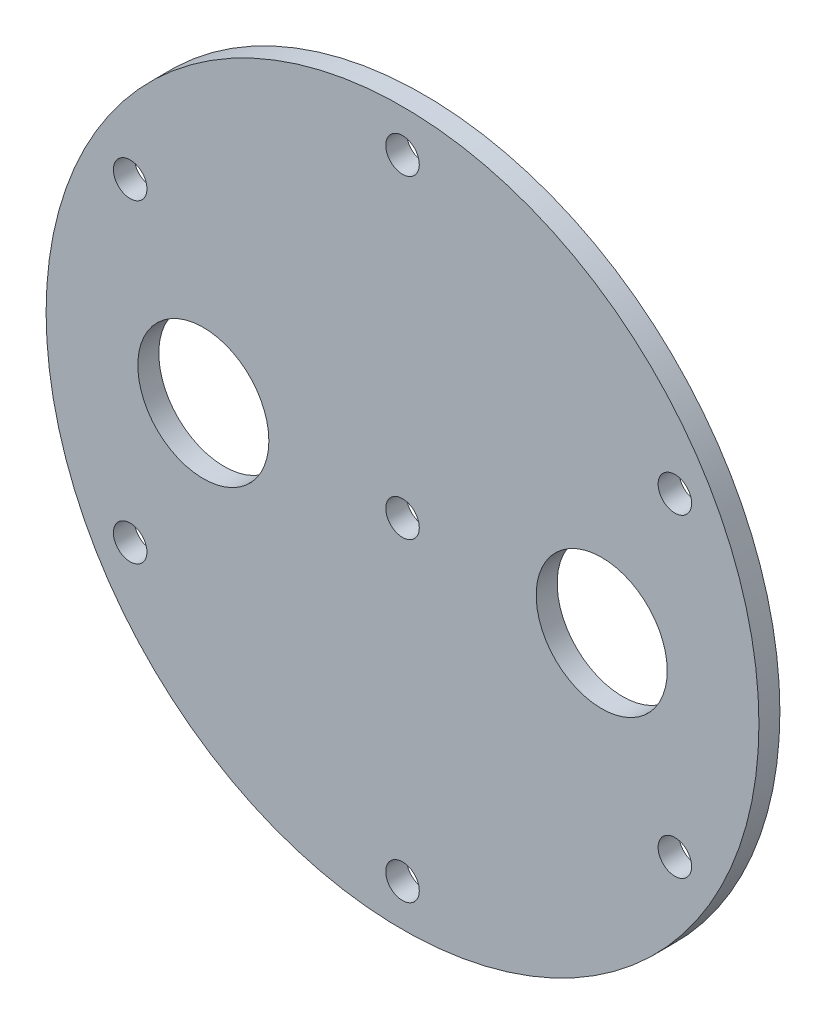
SolidWorks part; units mm, degrees
ref_plane "Vorne" through (0, 0, 0) normal (0, 0, 1) x (1, 0, 0)
ref_plane "Oben" through (0, 0, 0) normal (0, 1, 0) x (1, 0, 0)
ref_plane "Rechts" through (0, 0, 0) normal (1, 0, 0) x (0, 0, -1)
sketch "Skizze1" plane through (0, 0, 0) normal (0, 0, 1) x (1, 0, 0)
  circle A0 centre (0, 0) radius 34
  dimension "D1" = 68
extrude "Linear austragen1" add sketch "Skizze1" against normal blind 2
hole_wizard "Ø3.2 (3.2) Durchmesser Bohrung1" positions "Skizze3" profile "Skizze2" hole size "Ø3.2" standard "ISO"
sketch "Skizze3" plane through (0, 0, 0) normal (0, 0, 1) x (1, 0, 0)
  point P0 (0, 30)
  dimension "D1" = 30
sketch "Skizze2" plane through (0, 30, 0) normal (1, 0, 0) x (0, -1, 0)
  line L0 (0, 0) -> (0, 2)
  line L1 (0, 2) -> (1.6, 2)
  line L2 (1.6, 2) -> (1.6, 0)
  line L5 (1.6, 0) -> (0, 0)
  line L11 (0, -6.35) -> (0, 107.95) construction
  dimension "Bohrerdurchmesser" = 3.2
  dimension "Bohrungstiefe" = 2
pattern_circular "Kreismuster1" count 6 over 360 about axis through (0, 0, 0) along (0, 0, 1) of "Ø3.2 (3.2) Durchmesser Bohrung1"
sketch "Skizze5" plane through (0, 0, 0) normal (0, 0, 1) x (1, 0, 0)
  circle A0 centre (0, 0) radius 1.6
  circle A1 centre (-19, 0) radius 6.25
  circle A2 centre (19, 0) radius 6.25
  dimension "D1" = 12.5
  dimension "D2" = 12.5
  dimension "D3" = 3.2
  dimension "D4" = 19
  dimension "D5" = 38
extrude "Linear austragen2" cut sketch "Skizze5" against normal through all
